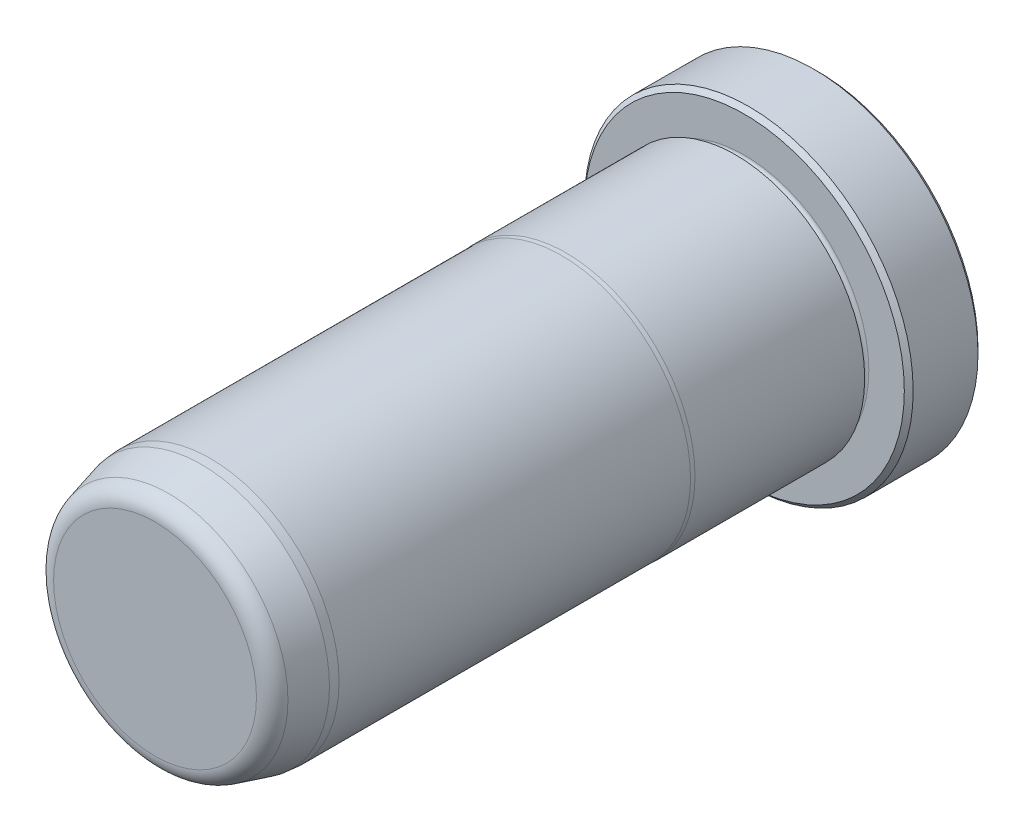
SolidWorks part; units mm, degrees
ref_plane "Front Plane" through (0, 0, 0) normal (0, 0, 1) x (1, 0, 0)
ref_plane "Top Plane" through (0, 0, 0) normal (0, 1, 0) x (1, 0, 0)
ref_plane "Right Plane" through (0, 0, 0) normal (1, 0, 0) x (0, 0, -1)
sketch "Sketch1" plane through (0, 0, 0) normal (1, 0, 0) x (0, 0, -1)
  line L0 (0, 0) -> (0, 14.1605)
  line L1 (0, 14.1605) -> (-6.35, 14.1605)
  line L2 (-6.35, 14.1605) -> (-6.35, 10.7188)
  line L3 (-6.35, 10.3378) -> (-7.112, 10.3378) construction
  line L4 (-7.112, 10.7188) -> (-7.112, 11.1252)
  line L5 (-7.112, 11.1252) -> (-21.7348, 11.1252)
  line L6 (-21.7348, 11.1252) -> (-22.098, 11.0998)
  line L7 (-22.098, 11.0998) -> (-52.3875, 11.0998)
  line L9 (-57.15, 9.9612) -> (-57.15, 0)
  line L10 (-57.15, 0) -> (0, 0)
  line L11 (0, 0) -> (13.6287, 0) construction
  line L12 (-52.3875, 11.0998) -> (-53.1495, 11.0331)
  line L13 (-53.1495, 11.0331) -> (-57.15, 9.9612)
  arc A0 (-7.112, 10.7188) -> (-6.35, 10.7188) centre (-6.731, 10.7188) ccw
  dimension "D14" = 0.762
  dimension "D1" = 6.35
  dimension "D2" = 0.762
  dimension "D3" = 28.321
  dimension "D4" = 22.2504
  dimension "D5" = 22.098
  dimension "D6" = 57.15
  dimension "D7" = 0.7874
  dimension "D8" = 4
  dimension "D9" = 22.1996
  dimension "D10" = 5
  dimension "D11" = 15
  dimension "D12" = 0.762
  dimension "D13" = 4.7625
revolve "Revolve1" add sketch "Sketch1" angle 360 about L11
fillet "Fillet6" radius 1.5875 1 edges at (9.9612, 0, 57.15)
chamfer "Chamfer1" distance 0.381 angle 45 2 edges at (14.1605, 0, 0) (14.1605, 0, 6.35)
